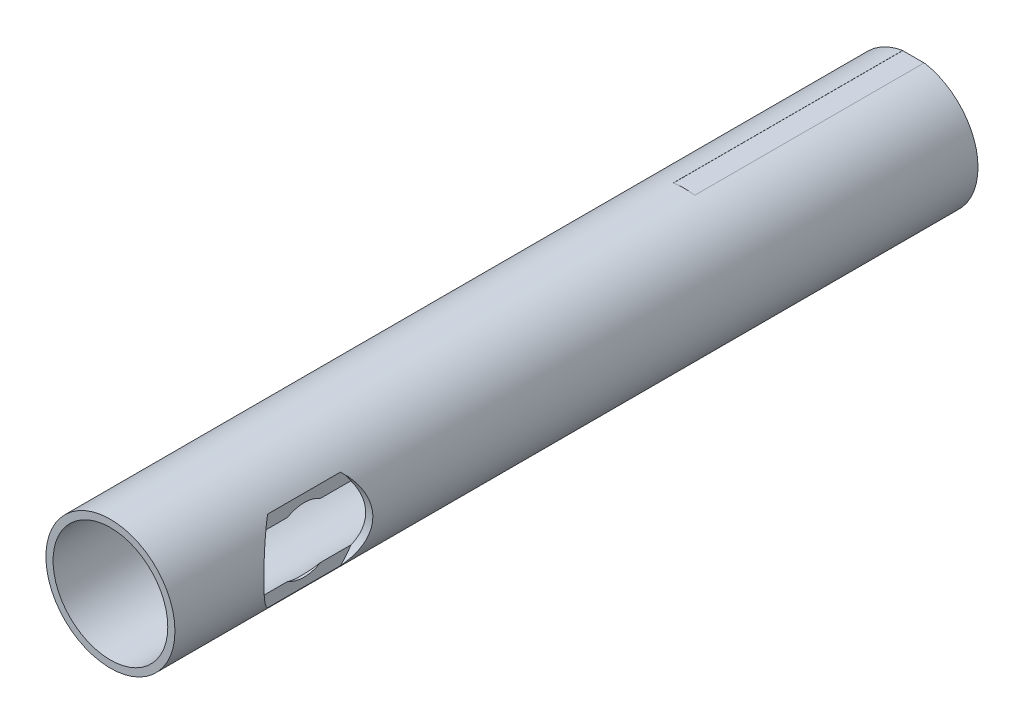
SolidWorks part; units mm, degrees
ref_plane "Front Plane" through (0, 0, 0) normal (0, 0, 1) x (1, 0, 0)
ref_plane "Top Plane" through (0, 0, 0) normal (0, 1, 0) x (1, 0, 0)
ref_plane "Right Plane" through (0, 0, 0) normal (1, 0, 0) x (0, 0, -1)
sketch "Sketch1" plane through (0, 0, 0) normal (0, 0, 1) x (1, 0, 0)
  circle A0 centre (0, 0) radius 25.4
  circle A1 centre (0, 0) radius 28.575
  dimension "D1" = 50.8
  dimension "D2" = 3.175
extrude "Boss-Extrude1" add sketch "Sketch1" against normal blind 355.6
sketch "Sketch2" plane through (0, 0, 0) normal (1, 0, 0) x (0, 0, -1)
  line L0 (0, 28.575) -> (0, -28.575) construction
  circle A0 centre (63.5, 0) radius 24.13
  dimension "D1" = 48.26
  dimension "D2" = 63.5
extrude "Cut-Extrude1" cut sketch "Sketch2" along normal blind 25.4 from offset 22.225
sketch "Sketch3" plane through (22.225, 0, 0) normal (1, 0, 0) x (0, 0, -1)
  circle A0 centre (63.5, 0) radius 14.2875
  arc A1 (42.7383, 12.2967) -> (42.7383, -12.2967) centre (63.5, 0) ccw construction
  dimension "D1" = 28.575
extrude "Cut-Extrude2" cut sketch "Sketch3" against normal blind 6.35
sketch "Sketch4" plane through (0, 0, 0) normal (0, 1, 0) x (1, 0, 0)
  line L0 (25.4, 355.6) -> (-25.4, 355.6) construction
  line L1 (-4.7498, 355.6) -> (4.7498, 355.6)
  line L2 (-4.7498, 355.6) -> (-4.7498, 254)
  line L3 (-4.7498, 254) -> (4.7498, 254)
  line L4 (4.7498, 355.6) -> (4.7498, 254)
  dimension "D1" = 4.7498
  dimension "D2" = 4.7498
  dimension "D3" = 101.6
extrude "Cut-Extrude3" cut sketch "Sketch4" against normal through all from offset 28.067
sketch "Sketch6" plane through (0, -28.067, 0) normal (0, -1, 0) x (1, 0, 0)
  line L1 (-4.7498, -254) -> (4.7498, -254)
  line L2 (-4.7498, -254) -> (-4.7498, -355.6)
  line L3 (-4.7498, -355.6) -> (4.7498, -355.6)
  line L4 (4.7498, -254) -> (4.7498, -355.6)
extrude "Cut-Extrude5" cut sketch "Sketch6" against normal blind 2.54 from offset 56.1848
